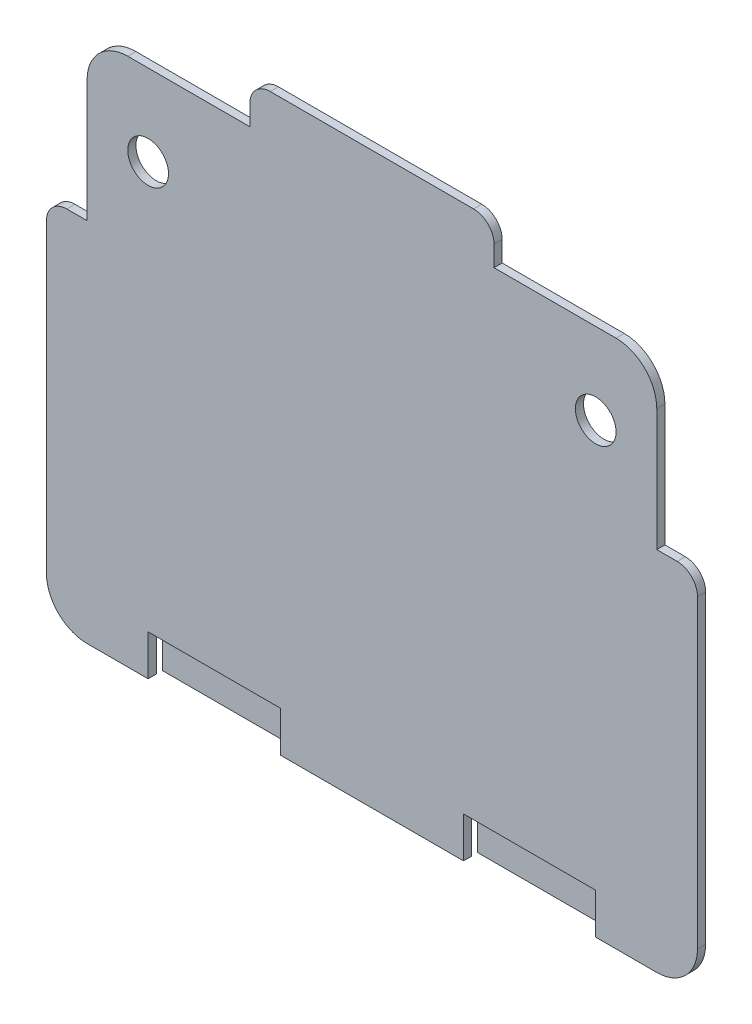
SolidWorks part; units mm, degrees
ref_plane "Front Plane" through (0, 0, 0) normal (0, 0, 1) x (1, 0, 0)
ref_plane "Top Plane" through (0, 0, 0) normal (0, 1, 0) x (1, 0, 0)
ref_plane "Right Plane" through (0, 0, 0) normal (1, 0, 0) x (0, 0, -1)
sketch "Sketch1" plane through (0, 0, 0) normal (0, 0, 1) x (1, 0, 0)
  line L1 (97.4074, -36.4815) -> (97.4074, 53.5185)
  line L9 (-5.0926, -36.4815) -> (39.9074, -36.4815)
  line L10 (39.9074, -36.4815) -> (39.9074, -26.4815)
  line L11 (39.9074, -26.4815) -> (72.4074, -26.4815)
  line L12 (72.4074, -26.4815) -> (72.4074, -36.4815)
  line L14 (72.4074, -36.4815) -> (97.4074, -36.4815)
  line L15 (17.4074, -36.4815) -> (17.4074, 103.5185) construction
  line L16 (-12.5926, 103.5185) -> (47.4074, 103.5185)
  line L19 (97.4074, 53.5185) -> (87.4074, 53.5185)
  line L20 (87.4074, 53.5185) -> (87.4074, 93.5185)
  line L21 (87.4074, 93.5185) -> (47.4074, 93.5185)
  line L22 (47.4074, 93.5185) -> (47.4074, 103.5185)
  line L24 (-62.5926, 53.5185) -> (-52.5926, 53.5185)
  line L26 (-12.5926, 93.5185) -> (-12.5926, 103.5185)
  line L27 (-52.5926, 93.5185) -> (-12.5926, 93.5185)
  line L28 (-52.5926, 53.5185) -> (-52.5926, 93.5185)
  line L29 (-37.5926, -36.4815) -> (-62.5926, -36.4815)
  line L30 (-37.5926, -26.4815) -> (-37.5926, -36.4815)
  line L31 (-5.0926, -26.4815) -> (-37.5926, -26.4815)
  line L32 (-5.0926, -36.4815) -> (-5.0926, -26.4815)
  line L33 (-62.5926, -36.4815) -> (-62.5926, 53.5185)
  dimension "D2" = 22.5
  dimension "D3" = 30
  dimension "D5" = 25
  dimension "D6" = 10
  dimension "D7" = 90
  dimension "D9" = 10
  dimension "D10" = 10
  dimension "D11" = 40
  dimension "D12" = 40
extrude "Boss-Extrude1" add sketch "Sketch1" along normal blind 2
sketch "Sketch2" plane through (0, 0, 0) normal (0, 0, -1) x (-1, 0, 0)
  line L0 (-72.4074, -26.4815) -> (-72.4074, -25.2815)
  line L1 (-72.4074, -25.2815) -> (-39.9074, -25.2815)
  line L2 (-39.9074, -25.2815) -> (-39.9074, -26.4815)
  line L3 (5.0926, -26.4815) -> (5.0926, -25.2815)
  line L4 (5.0926, -25.2815) -> (37.5926, -25.2815)
  line L5 (37.5926, -25.2815) -> (37.5926, -26.4815)
  line L20 (12.5926, 93.5185) -> (12.5926, 103.5185)
  line L21 (12.5926, 103.5185) -> (-47.4074, 103.5185)
  line L22 (-47.4074, 103.5185) -> (-47.4074, 93.5185)
  line L23 (-47.4074, 93.5185) -> (-87.4074, 93.5185)
  line L24 (-87.4074, 93.5185) -> (-87.4074, 53.5185)
  line L25 (-87.4074, 53.5185) -> (-97.4074, 53.5185)
  line L26 (-97.4074, 53.5185) -> (-97.4074, -36.4815)
  line L27 (-97.4074, -36.4815) -> (-72.4074, -36.4815)
  line L28 (-72.4074, -36.4815) -> (-72.4074, -26.4815)
  line L29 (-72.4074, -26.4815) -> (-39.9074, -26.4815)
  line L30 (-39.9074, -26.4815) -> (-39.9074, -36.4815)
  line L31 (-39.9074, -36.4815) -> (5.0926, -36.4815)
  line L32 (5.0926, -36.4815) -> (5.0926, -26.4815)
  line L33 (5.0926, -26.4815) -> (37.5926, -26.4815)
  line L34 (37.5926, -26.4815) -> (37.5926, -36.4815)
  line L35 (37.5926, -36.4815) -> (62.5926, -36.4815)
  line L36 (62.5926, -36.4815) -> (62.5926, 53.5185)
  line L37 (62.5926, 53.5185) -> (52.5926, 53.5185)
  line L38 (52.5926, 53.5185) -> (52.5926, 93.5185)
  line L39 (52.5926, 93.5185) -> (12.5926, 93.5185)
  line L40 (12.5926, 93.5185) -> (12.5926, 103.5185)
  line L41 (12.5926, 103.5185) -> (-47.4074, 103.5185)
  line L42 (-47.4074, 103.5185) -> (-47.4074, 93.5185)
  line L43 (-47.4074, 93.5185) -> (-87.4074, 93.5185)
  line L44 (-87.4074, 93.5185) -> (-87.4074, 53.5185)
  line L45 (-87.4074, 53.5185) -> (-97.4074, 53.5185)
  line L46 (-97.4074, 53.5185) -> (-97.4074, -36.4815)
  line L47 (-97.4074, -36.4815) -> (-72.4074, -36.4815)
  line L48 (-72.4074, -36.4815) -> (-72.4074, -26.4815)
  line L49 (-72.4074, -26.4815) -> (-39.9074, -26.4815)
  line L50 (-39.9074, -26.4815) -> (-39.9074, -36.4815)
  line L51 (-39.9074, -36.4815) -> (5.0926, -36.4815)
  line L52 (5.0926, -36.4815) -> (5.0926, -26.4815)
  line L53 (5.0926, -26.4815) -> (37.5926, -26.4815)
  line L54 (37.5926, -26.4815) -> (37.5926, -36.4815)
  line L55 (37.5926, -36.4815) -> (62.5926, -36.4815)
  line L56 (62.5926, -36.4815) -> (62.5926, 53.5185)
  line L57 (62.5926, 53.5185) -> (52.5926, 53.5185)
  line L58 (52.5926, 53.5185) -> (52.5926, 93.5185)
  line L59 (52.5926, 93.5185) -> (12.5926, 93.5185)
  dimension "D2" = 1.2
  dimension "D3" = 1.2
  dimension "D1" = 0
extrude "Boss-Extrude2" add sketch "Sketch2" along normal blind 1.5 contours L2 L1 L0 M32 | L5 L4 L3 M36
sketch "Sketch3" plane through (0, 0, -1.5) normal (0, 0, -1) x (-1, 0, 0)
  line L0 (5.0926, -26.4815) -> (5.0926, -36.4815) construction
  line L1 (37.5926, -36.4815) -> (37.5926, -26.4815) construction
  line L2 (5.0926, -26.4815) -> (5.0926, -36.4815)
  line L3 (37.5926, -36.4815) -> (37.5926, -26.4815)
  line L4 (37.5926, -26.4815) -> (37.5926, -25.2815)
  line L5 (37.5926, -25.2815) -> (5.0926, -25.2815)
  line L6 (5.0926, -25.2815) -> (5.0926, -26.4815)
  line L7 (5.0926, -26.4815) -> (37.5926, -26.4815)
  line L8 (37.5926, -26.4815) -> (37.5926, -25.2815)
  line L9 (37.5926, -25.2815) -> (5.0926, -25.2815)
  line L10 (5.0926, -25.2815) -> (5.0926, -26.4815)
  line L12 (37.5926, -25.2815) -> (37.5926, -36.4815)
  line L13 (5.0926, -36.4815) -> (37.5926, -36.4815)
  line L14 (5.0926, -36.4815) -> (5.0926, -25.2815)
  dimension "D1" = 0
extrude "Boss-Extrude3" add sketch "Sketch3" along normal blind 1.2 contours L2 L13 L3 M8 | M8 M5 M6 M7
sketch "Sketch4" plane through (0, 0, -1.5) normal (0, 0, -1) x (-1, 0, 0)
  line L0 (-72.4074, -26.4815) -> (-72.4074, -36.4815) construction
  line L1 (-72.4074, -25.2815) -> (-39.9074, -25.2815) construction
  line L2 (-39.9074, -36.4815) -> (-39.9074, -26.4815) construction
  line L3 (-72.4074, -26.4815) -> (-72.4074, -36.4815)
  line L4 (-72.4074, -25.2815) -> (-39.9074, -25.2815)
  line L5 (-39.9074, -36.4815) -> (-39.9074, -26.4815)
  line L6 (-39.9074, -25.2815) -> (-39.9074, -36.4815)
  line L7 (-72.4074, -36.4815) -> (-39.9074, -36.4815)
  line L8 (-72.4074, -36.4815) -> (-72.4074, -25.2815)
extrude "Boss-Extrude4" add sketch "Sketch4" along normal blind 1.2 contours L3 L7 L5 M4 | M4 M1 M2 M3
sketch "Sketch5" plane through (0, 0, 2) normal (0, 0, 1) x (1, 0, 0)
  line L0 (97.4074, -36.4815) -> (97.4074, 53.5185) construction
  line L1 (97.4074, -36.4815) -> (97.4074, 53.5185)
  line L2 (97.4074, 53.5185) -> (72.4074, 53.5185)
  line L3 (72.4074, 53.5185) -> (72.4074, 73.5185)
  line L4 (17.4074, -36.4815) -> (17.4074, 116.6345) construction
  line L5 (-5.0926, -36.4815) -> (39.9074, -36.4815) construction
  circle A0 centre (72.4074, 73.5185) radius 5
  circle A1 centre (-37.5926, 73.5185) radius 5
  dimension "D3" = 10
  dimension "D1" = 25
  dimension "D2" = 20
extrude "Cut-Extrude1" cut sketch "Sketch5" against normal through all
fillet "Fillet3" radius 10 1 edges at (-52.5926, 93.5185, 1)
fillet "Fillet4" radius 10 3 edges at (-62.5926, -36.4815, 1) (97.4074, -36.4815, 1) (87.4074, 93.5185, 1)
fillet "Fillet5" radius 5 4 edges at (97.4074, 53.5185, 1) (47.4074, 103.5185, 1) (-12.5926, 103.5185, 1) (-62.5926, 53.5185, 1)
